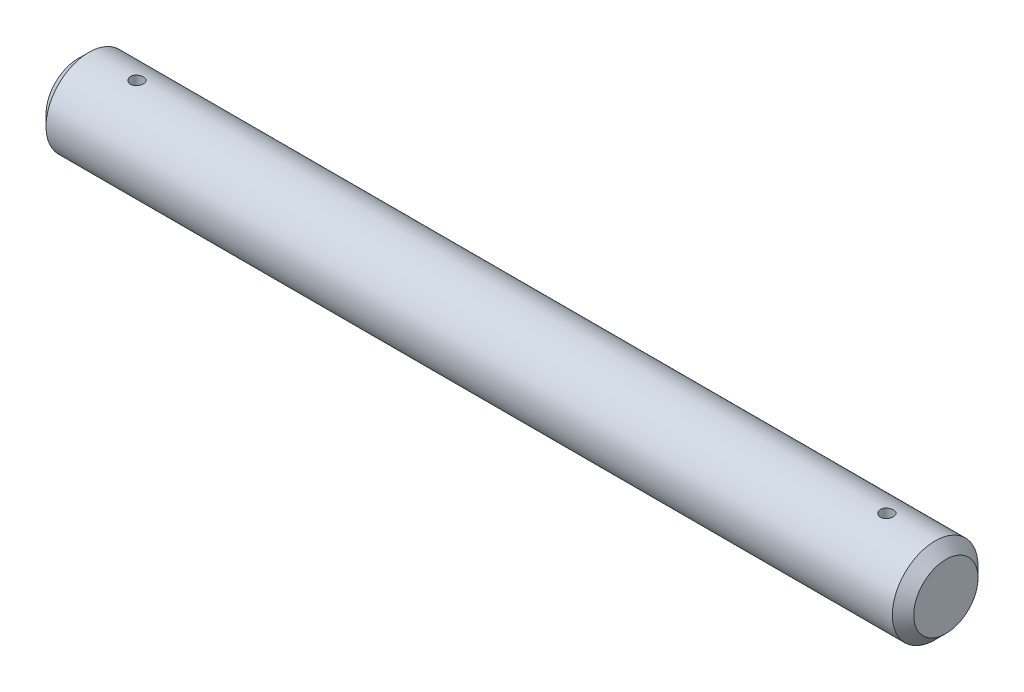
SolidWorks part; units mm, degrees
ref_plane "Plan de face" through (0, 0, 0) normal (0, 0, 1) x (1, 0, 0)
ref_plane "Plan de dessus" through (0, 0, 0) normal (0, 1, 0) x (1, 0, 0)
ref_plane "Plan de droite" through (0, 0, 0) normal (1, 0, 0) x (0, 0, -1)
sketch "Esquisse1" plane through (0, 0, 0) normal (1, 0, 0) x (0, 0, -1)
  circle A0 centre (0, 0) radius 4
  dimension "D1" = 8
extrude "Boss.-Extru.1" add sketch "Esquisse1" along normal mid plane 81
chamfer "Chanfrein1" distance 1 angle 45 2 edges at (-40.5, 0, -4) (40.5, 0, -4)
sketch "Esquisse2" plane through (0, 0, 0) normal (0, 1, 0) x (1, 0, 0)
  line L0 (-40.5, 3) -> (-40.5, -3) construction
  line L1 (40.5, -3) -> (40.5, 3) construction
  circle A0 centre (-35, 0) radius 0.6
  circle A1 centre (35, 0) radius 0.6
  dimension "D1" = 5.5
  dimension "D3" = 1.2
  dimension "D4" = 1.2
  dimension "D2" = 5.5
extrude "Enlèv. mat.-Extru.1" cut sketch "Esquisse2" against normal mid plane 10
